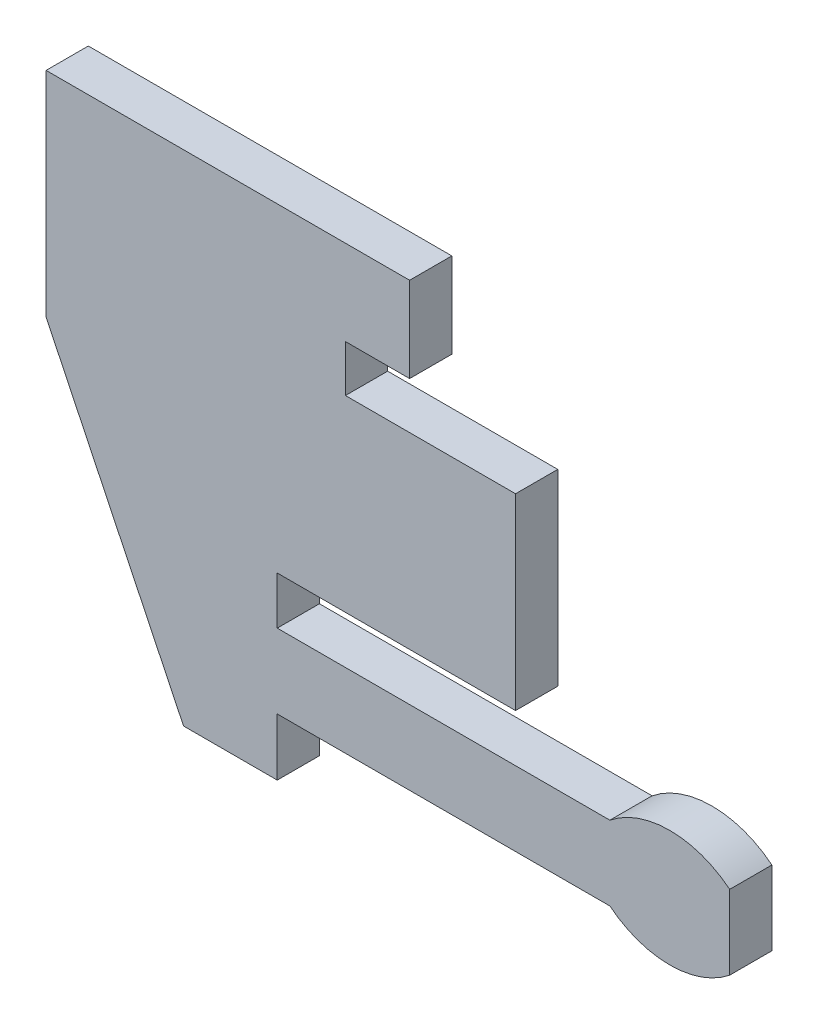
SolidWorks part; units mm, degrees
ref_plane "Front Plane" through (0, 0, 0) normal (0, 0, 1) x (1, 0, 0)
ref_plane "Top Plane" through (0, 0, 0) normal (0, 1, 0) x (1, 0, 0)
ref_plane "Right Plane" through (0, 0, 0) normal (1, 0, 0) x (0, 0, -1)
sketch "Sketch1" plane through (0, 0, 0) normal (0, 0, 1) x (1, 0, 0)
  line L0 (-8.8154, 0.1642) -> (-8.8154, -1.524)
  line L2 (-8.8154, -1.524) -> (-2.6734, -1.524)
  line L3 (-2.6734, -1.524) -> (-2.6734, -8.3045)
  line L4 (-2.6734, -8.3045) -> (-11.278, -8.3045)
  line L5 (-11.278, -8.3045) -> (-11.278, -10.0282)
  line L6 (-11.278, -10.0282) -> (0.7317, -10.0282)
  line L7 (5.0585, -10.0282) -> (5.0585, -12.7118)
  line L8 (5.0585, -11.37) -> (14.9087, -11.37) construction
  line L9 (0.7317, -12.7118) -> (-11.278, -12.7118)
  line L10 (-11.278, -12.7118) -> (-11.278, -14.781)
  line L11 (-11.278, -14.781) -> (-14.6613, -14.781)
  line L12 (-14.6613, -14.781) -> (-19.624, -4.4758)
  line L13 (-19.624, -4.4758) -> (-19.624, 3.2395)
  line L14 (-19.624, 3.2395) -> (-6.4985, 3.2395)
  line L15 (-6.4985, 3.2395) -> (-6.4985, 0.1642)
  line L16 (-6.4985, 0.1642) -> (-8.8154, 0.1642)
  arc A0 (0.7317, -10.0282) -> (5.0585, -10.0282) centre (2.8951, -12.7118) cw
  arc A1 (0.7317, -12.7118) -> (5.0585, -12.7118) centre (2.8951, -10.0282) ccw
extrude "Boss-Extrude1" add sketch "Sketch1" along normal blind 1.524
